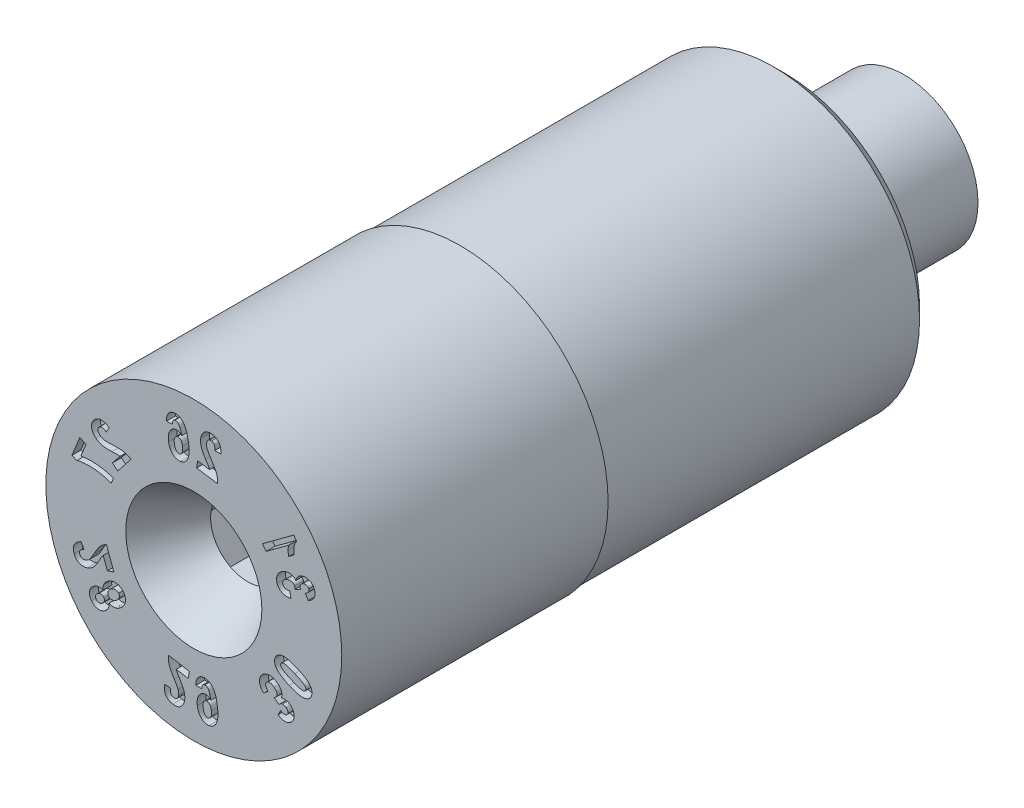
SolidWorks part; units mm, degrees
other "<M5L8-SetScrew>-<Chamfer1>"
ref_plane "Front Plane" through (0, 0, 0) normal (0, 0, 1) x (1, 0, 0)
ref_plane "Top Plane" through (0, 0, 0) normal (0, 1, 0) x (1, 0, 0)
ref_plane "Right Plane" through (0, 0, 0) normal (1, 0, 0) x (0, 0, -1)
sketch "Sketch1" plane through (0, 0, 0) normal (1, 0, 0) x (0, 0, -1)
  line L0 (0, 2.3) -> (1.8187, 1.25)
  line L2 (0, 5) -> (0, 2.3)
  line L3 (19.525, 5) -> (0, 5)
  line L4 (-3.7979, 0) -> (49996.2021, 0) construction
  line L8 (16, 1.25) -> (1.8187, 1.25)
  line L12 (20, 2.5) -> (20, 4.525)
  line L16 (20, 4.525) -> (19.525, 5)
  line L17 (20, 2.5) -> (16, 2.5)
  line L18 (16, 1.25) -> (16, 2.5)
  dimension "D1" = 20
  dimension "D2" = 45
  dimension "D3" = 0.475
  dimension "D4" = 10
  dimension "D5" = 30
  dimension "D6" = 2.3
  dimension "D7" = 2.5
  dimension "D8" = 5
  dimension "D9" = 4
revolve "Revolve1" add sketch "Sketch1" angle 360 about L4
sketch "Sketch5" plane through (0, 0, 0) normal (1, 0, 0) x (0, 0, -1)
  line L0 (0, 0) -> (50000, 0) construction
  line L1 (0, 5) -> (0, -5) construction
  line L2 (9, 4.935) -> (20, 4.935)
  line L3 (9, 4.935) -> (9, 5.935)
  line L4 (9, 5.935) -> (20, 5.935)
  line L5 (20, 4.935) -> (20, 5.935)
  line L6 (20, -4.525) -> (20, 4.525) construction
  line L7 (19.525, 5) -> (0, 5) construction
  dimension "D1" = 9
  dimension "D2" = 0.065
  dimension "D3" = 1
revolve "Cut-Revolve1" cut sketch "Sketch5" angle 360 about L0
sketch "Sketch2" plane through (0, 0, 0) normal (0, 0, 1) x (1, 0, 0)
  line L0 (0, 0) -> (0, 5) construction
  line L1 (0, 0) -> (4.3301, 2.5) construction
  line L2 (0, 0) -> (4.3301, -2.5) construction
  line L3 (0, 0) -> (0, -5) construction
  line L4 (0, 0) -> (-4.3301, -2.5) construction
  line L5 (0, 0) -> (-4.3301, 2.5) construction
  arc A0 (0.8445, 2.9254) -> (1.4772, 2.6626) centre (0, 0) ccw construction
  circle A1 centre (0, 0) radius 5 construction
  text T0 "26   27   28   29   30   31" font "Arial Narrow" height 1.3
  point P17 (0, 0)
  dimension "D2" = 6
extrude "Cut-Extrude1" cut sketch "Sketch2" against normal blind 0.3
ref_plane "Plane1" through (0, 0, -1.8187) normal (0, 0, 1) x (1, 0, 0)
sketch "Sketch6" plane through (0, 0, -1.8187) normal (0, 0, 1) x (1, 0, 0)
  line L1 (1.4434, 0) -> (0.7217, 1.25)
  line L2 (0.7217, 1.25) -> (-0.7217, 1.25)
  line L3 (-0.7217, 1.25) -> (-1.4434, 0)
  line L4 (-1.4434, 0) -> (-0.7217, -1.25)
  line L5 (-0.7217, -1.25) -> (0.7217, -1.25)
  line L6 (0.7217, -1.25) -> (1.4434, 0)
  circle A0 centre (0, 0) radius 1.25 construction
  circle A1 centre (0, 0) radius 1.25 construction
  point P1 (0, 1.25)
extrude "Cut-Extrude2" cut sketch "Sketch6" against normal blind 2.5
inserted part "M5L8-SetScrew"
move or copy body "Body-Move/Copy2" placed by mates yes
other "Distance1" parameters "D1"=4
